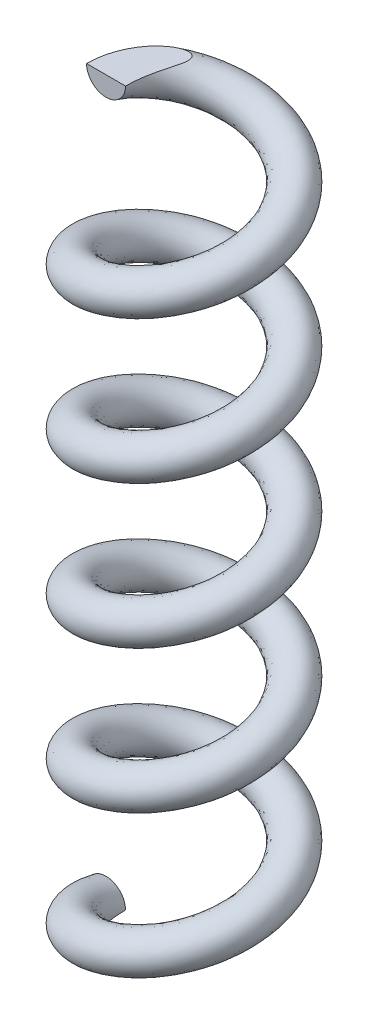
SolidWorks part; units mm, degrees
ref_plane "Front Plane" through (0, 0, 0) normal (0, 0, 1) x (1, 0, 0)
ref_plane "Top Plane" through (0, 0, 0) normal (0, 1, 0) x (1, 0, 0)
ref_plane "Right Plane" through (0, 0, 0) normal (1, 0, 0) x (0, 0, -1)
sketch "Sketch1" plane through (0, 0, 0) normal (0, 0, 1) x (1, 0, 0)
  line L1 (-24, -71.5) -> (-38, -71.5) construction
  circle A0 centre (-38, -71.5) radius 3.5
  dimension "D3" = 7
  dimension "D2" = 14
sketch "Sketch5" plane through (0, 0, 0) normal (0, 0, 1) x (1, 0, 0)
  line L0 (-24, -71.5) -> (-24, 56.6221)
  line L3 (-29, 56.6221) -> (-19, 56.6221) construction
sweep "Sweep3" add profiles "Sketch1" path "Sketch5" parameters "D4"=1800
ref_plane "Plane3" through (0, 56.6221, 0) normal (0, 1, 0) x (1, 0, 0)
ref_plane "Plane4" through (0, -71.5, 0) normal (0, 1, 0) x (1, 0, 0)
other "SurfaceCut1"
other "SurfaceCut2"
